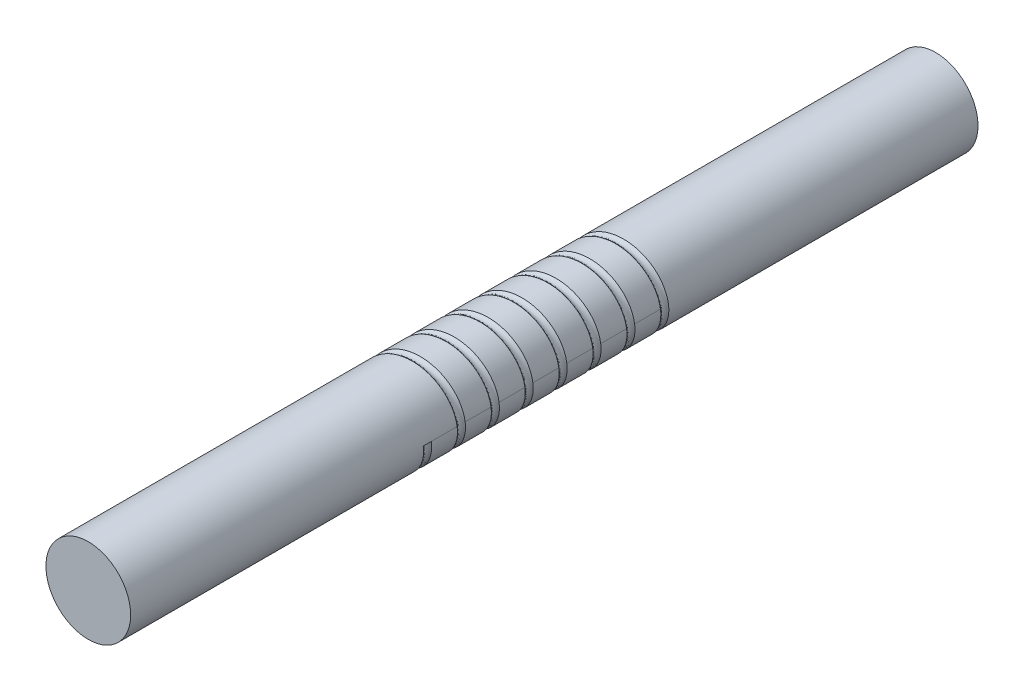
SolidWorks part; units mm, degrees
ref_plane "Front Plane" through (0, 0, 0) normal (0, 0, 1) x (1, 0, 0)
ref_plane "Top Plane" through (0, 0, 0) normal (0, 1, 0) x (1, 0, 0)
ref_plane "Right Plane" through (0, 0, 0) normal (1, 0, 0) x (0, 0, -1)
sketch "Sketch1" plane through (0, 0, 0) normal (0, 0, 1) x (1, 0, 0)
  circle A0 centre (0, 0) radius 25
  dimension "D1" = 50
extrude "Boss-Extrude1" add sketch "Sketch1" along normal blind 500
ref_plane "Plane1" through (0, 0, 175) normal (0, 0, 1) x (1, 0, 0)
sketch "Sketch2" plane through (0, 0, 175) normal (0, 0, 1) x (1, 0, 0)
  circle A0 centre (0, 0) radius 27.1167
  dimension "D1" = 54.2333
curve "Helix/Spiral1"
sketch "Sketch3" plane through (0, 0, 0) normal (0, 1, 0) x (1, 0, 0)
  circle A0 centre (-27.1167, -175) radius 3.175
  spline S0 degree 3 number of poles 176 (-27.1167, -175) -> (27.1167, -325) construction
  dimension "D1" = 6.35
sweep "Cut-Sweep1" cut profiles "Sketch3" path "Helix/Spiral1"
pattern_linear "LPattern1" [suppressed] count 2 spacing 500
